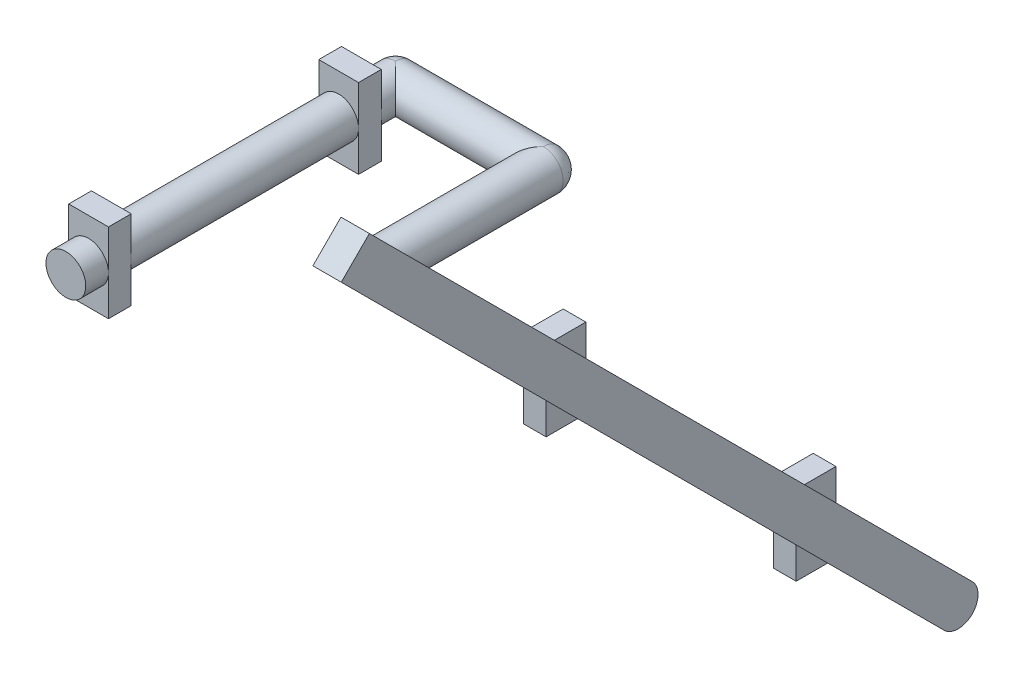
SolidWorks part; units mm, degrees
ref_plane "Face" through (0, 0, 0) normal (0, 0, 1) x (1, 0, 0)
ref_plane "Dessus" through (0, 0, 0) normal (0, 1, 0) x (1, 0, 0)
ref_plane "Droite" through (0, 0, 0) normal (1, 0, 0) x (0, 0, -1)
sketch "Esquisse1" plane through (0, 0, 0) normal (0, 0, 1) x (1, 0, 0)
  circle A0 centre (0, 0) radius 3.5
  dimension "D1" = 7
extrude "Extrusion1" add sketch "Esquisse1" along normal blind 20
sketch "Esquisse2" plane through (0, 0, 20) normal (0, 0, 1) x (1, 0, 0)
  line L1 (-3.5, 7) -> (3.5, 7)
  line L2 (-3.5, 7) -> (-3.5, -7)
  line L3 (-3.5, -7) -> (3.5, -7)
  line L4 (3.5, 7) -> (3.5, -7)
  circle A0 centre (0, 0) radius 3.5 construction
  dimension "D1" = 7
  dimension "D2" = 7
extrude "Extrusion2" add sketch "Esquisse2" along normal blind 4
sketch "Esquisse3" plane through (0, 0, 24) normal (0, 0, 1) x (1, 0, 0)
  circle A0 centre (0, 0) radius 3.5
  dimension "D1" = 7
extrude "Extrusion3" add sketch "Esquisse3" along normal blind 4
mirror "Symétrie1" about plane through (0, 0, 0) normal (0, 0, 1) of "Extrusion2", "Extrusion1"
sketch "Esquisse4" plane through (0, 0, -24) normal (0, 0, -1) x (-1, 0, 0)
  circle A0 centre (0, 0) radius 3.5
  dimension "D1" = 7
extrude "Extrusion4" add sketch "Esquisse4" along normal blind 6
sketch "Esquisse5" plane through (0, 0, 0) normal (1, 0, 0) x (0, 0, -1)
  line L0 (30, -3.5) -> (30, 3.5) construction
  circle A0 centre (30, 0) radius 3.5
extrude "Extrusion5" add sketch "Esquisse5" along normal blind 26
sketch "Esquisse6" plane through (0, 0, 0) normal (0, 1, 0) x (1, 0, 0)
  line L0 (26, 30) -> (26, -8.2883) construction
  line L1 (26, 26.5) -> (26, 33.5) construction
  line L3 (26, 30) -> (29.5, 30)
  line L4 (26, 30) -> (26, 0)
  line L5 (26, 0) -> (29.5, 0)
  line L6 (29.5, 30) -> (29.5, 0)
  dimension "D1" = 3.5
revolve "Révolution1" add sketch "Esquisse6" angle 360 about L0
sketch "Esquisse7" plane through (0, 0, 0) normal (0, 1, 0) x (1, 0, 0)
  line L0 (26, 0) -> (55.2162, 0) construction
  line L1 (22.5, 0) -> (29.5, 0) construction
  line L3 (26, 0) -> (56, 0)
  line L4 (26, 0) -> (26, -3.5)
  line L5 (26, -3.5) -> (56, -3.5)
  line L6 (56, 0) -> (56, -3.5)
  dimension "D1" = 3.5
  dimension "D2" = 30
revolve "Révolution2" add sketch "Esquisse7" angle 360 about L0
sketch "Esquisse8" plane through (56, 0, 0) normal (1, 0, 0) x (0, 0, -1)
  line L1 (-3.5, 7) -> (3.5, 7)
  line L2 (-3.5, 7) -> (-3.5, -7)
  line L3 (-3.5, -7) -> (3.5, -7)
  line L4 (3.5, 7) -> (3.5, -7)
  circle A0 centre (0, 0) radius 3.5 construction
  dimension "D1" = 7
  dimension "D2" = 7
extrude "Extrusion6" add sketch "Esquisse8" along normal blind 4
sketch "Esquisse9" plane through (60, 0, 0) normal (1, 0, 0) x (0, 0, -1)
  arc A0 (-3.5, 0) -> (3.5, 0) centre (0, 0) ccw construction
  arc A1 (-3.5, 0) -> (3.5, 0) centre (0, 0) ccw
  arc A2 (3.5, 0) -> (-3.5, 0) centre (0, 0) ccw construction
  arc A3 (3.5, 0) -> (-3.5, 0) centre (0, 0) ccw
extrude "Extrusion7" add sketch "Esquisse9" along normal blind 40
sketch "Esquisse10" plane through (100, 0, 0) normal (1, 0, 0) x (0, 0, -1)
  line L3 (3.5, 0) -> (3.5, 7)
  line L4 (3.5, 7) -> (-3.5, 7)
  line L5 (-3.5, 7) -> (-3.5, 0)
  line L6 (3.5, 0) -> (3.5, 7)
  line L7 (3.5, 7) -> (-3.5, 7)
  line L8 (-3.5, 7) -> (-3.5, 0)
  line L9 (-3.5, 0) -> (-3.5, -7)
  line L10 (-3.5, -7) -> (3.5, -7)
  line L11 (3.5, -7) -> (3.5, 0)
  line L12 (-3.5, 0) -> (-3.5, -7)
  line L13 (-3.5, -7) -> (3.5, -7)
  line L14 (3.5, -7) -> (3.5, 0)
  arc A1 (3.5, 0) -> (-3.5, 0) centre (0, 0) ccw
  arc A3 (-3.5, 0) -> (3.5, 0) centre (0, 0) ccw
  dimension "D1" = 0
  dimension "D2" = 0
extrude "Extrusion8" add sketch "Esquisse10" along normal blind 4
sketch "Esquisse11" plane through (104, 0, 0) normal (1, 0, 0) x (0, 0, -1)
  circle A0 centre (0, 0) radius 3.5
  dimension "D1" = 7
extrude "Extrusion9" add sketch "Esquisse11" along normal blind 20
sketch "Esquisse12" plane through (124, 0, 0) normal (1, 0, 0) x (0, 0, -1)
  line L0 (-103.5911, 108.5409) -> (2.4749, 2.4749)
  line L1 (-108.5409, 103.5911) -> (-2.4749, -2.4749)
  line L2 (-103.5911, 108.5409) -> (-108.5409, 103.5911)
  circle A1 centre (0, 0) radius 3.5
  arc A2 (-2.4749, -2.4749) -> (2.4749, 2.4749) centre (0, 0) ccw
  dimension "D2" = 150
  dimension "D1" = 0
extrude "Extrusion10" add sketch "Esquisse12" along normal blind 5
sketch "Esquisse13" plane through (0, 0, -30) normal (0, 0, -1) x (-1, 0, 0)
  line L0 (0, -11.3388) -> (0, 15.915) construction
  line L1 (0, 3.5) -> (0, -3.5)
  line L2 (0, 3.5) -> (0, -3.5)
  arc A1 (0, -3.5) -> (0, 3.5) centre (0, 0) ccw
  arc A2 (0, -3.5) -> (0, 3.5) centre (0, 0) ccw
  dimension "D1" = 0
revolve "Révolution3" add sketch "Esquisse13" angle 360 about L0
sketch "Esquisse14" plane through (0, 0, -30) normal (0, 0, -1) x (-1, 0, 0)
  line L0 (-26, -11.756) -> (-26, 14.8682) construction
  line L1 (-26, -3.5) -> (-26, 3.5)
  line L2 (-26, -3.5) -> (-26, 3.5)
  arc A1 (-26, 3.5) -> (-26, -3.5) centre (-26, 0) ccw
  arc A2 (-26, 3.5) -> (-26, -3.5) centre (-26, 0) ccw
  dimension "D1" = 0
revolve "Révolution4" add sketch "Esquisse14" angle 360 about L0
sketch "Esquisse15" plane through (0, 0, 0) normal (0, 0, 1) x (1, 0, 0)
  line L0 (26, 9.768) -> (26, -11.4054) construction
  line L1 (26, -3.5) -> (26, 3.5)
  line L2 (26, -3.5) -> (26, 3.5)
  arc A1 (26, 3.5) -> (26, -3.5) centre (26, 0) ccw
  arc A2 (26, 3.5) -> (26, -3.5) centre (26, 0) ccw
  dimension "D1" = 0
revolve "Révolution5" add sketch "Esquisse15" angle 360 about L0
